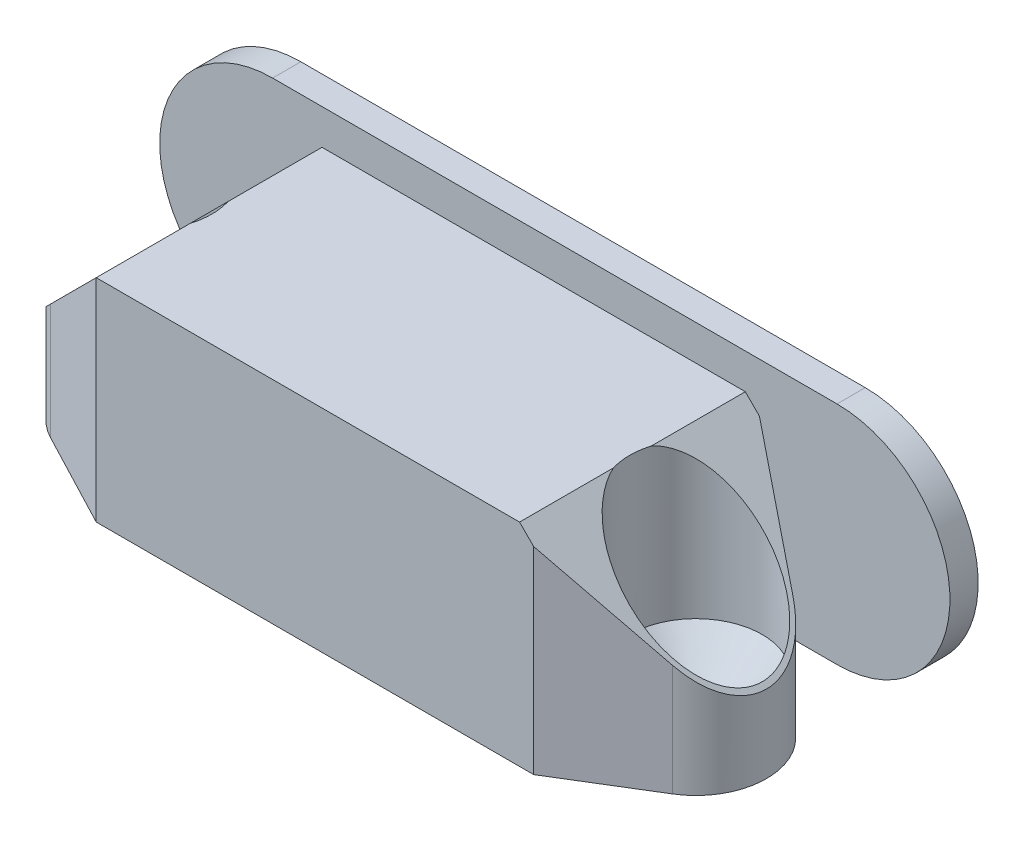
SolidWorks part; units mm, degrees
ref_plane "Plan de face" through (0, 0, 0) normal (0, 0, 1) x (1, 0, 0)
ref_plane "Plan de dessus" through (0, 0, 0) normal (0, 1, 0) x (1, 0, 0)
ref_plane "Plan de droite" through (0, 0, 0) normal (1, 0, 0) x (0, 0, -1)
sketch "Esquisse1" plane through (0, 0, 0) normal (0, 0, 1) x (1, 0, 0)
  line L0 (-20, -8) -> (20, -8)
  line L1 (20, 8) -> (-20, 8)
  arc A0 (20, -8) -> (20, 8) centre (20, 0) ccw
  arc A1 (-20, 8) -> (-20, -8) centre (-20, 0) ccw
  dimension "D1" = 8
  dimension "D2" = 56
  dimension "D3" = 28
extrude "Extrusion1" add sketch "Esquisse1" along normal blind 2
hole_wizard "Fraisage pour vis à tête fraisée M41" positions "Esquisse3" profile "Esquisse2" countersink size "M4" standard "ISO"
sketch "Esquisse3" plane through (0, 0, 2) normal (0, 0, 1) x (1, 0, 0)
  arc A0 (-20, 8) -> (-20, -8) centre (-20, 0) ccw construction
  arc A1 (20, -8) -> (20, 8) centre (20, 0) ccw construction
  point P0 (-20, 0)
  point P1 (20, 0)
sketch "Esquisse2" plane through (-20, 0, 2) normal (1, 0, 0) x (0, -1, 0)
  line L0 (0, 0) -> (0, 11.2919)
  line L1 (0, 11.2919) -> (2.15, 10)
  line L2 (2.15, 10) -> (2.15, 2.55)
  line L3 (2.15, 2.55) -> (4.7, 0)
  line L5 (4.7, 0) -> (0, 0)
  line L6 (-2.15, 2.55) -> (-4.7, 0) construction
  line L10 (0, 11.2919) -> (-2.15, 10) construction
  line L11 (0, -6.35) -> (0, 107.95) construction
  dimension "Diamètre du perçage" = 4.3
  dimension "Profondeur du perçage" = 10
  dimension "Diamètre du fraisage entrant" = 9.4
  dimension "Angle du fraisage entrant" = 90
  dimension "Angle de pointe" = 118
sketch "Esquisse5" plane through (0, -8, 0) normal (0, -1, 0) x (1, 0, 0)
  line L0 (-15, 3.5) -> (16, 3.5)
  line L1 (16, 3.5) -> (22.108, 7.234)
  line L2 (22.108, 15.766) -> (16, 19.5)
  line L3 (16, 19.5) -> (-15, 19.5)
  line L4 (-15, 19.5) -> (-21.8192, 15.9296)
  line L5 (-21.8192, 7.0704) -> (-15, 3.5)
  line L6 (-20, 2) -> (20, 2) construction
  arc A0 (22.108, 7.234) -> (22.108, 15.766) centre (19.5, 11.5) ccw
  arc A1 (-21.8192, 15.9296) -> (-21.8192, 7.0704) centre (-19.5, 11.5) ccw
  dimension "D3" = 49
  dimension "D5" = 5
  dimension "D6" = 5
  dimension "D1" = 16
  dimension "D2" = 1.5
  dimension "D4" = 24.5
  dimension "D7" = 8
  dimension "D8" = 31
  dimension "D9" = 9.5
extrude "Extrusion2" add sketch "Esquisse5" against normal blind 15
sketch "Esquisse6" plane through (0, 0, 19.5) normal (0, 0, 1) x (1, 0, 0)
  line L0 (-15, 7) -> (-30, -8)
  line L1 (-30, -8) -> (-30, 7)
  line L2 (-30, 7) -> (-15, 7)
  dimension "D1" = 45
  dimension "D2" = 15
extrude "Enlèv. mat.-Extru.1" cut sketch "Esquisse6" along direction (0, 0, -1) on the side against the normal up to next (17.5 mm away)
hole_wizard "Fraisage pour vis à tête fraisée M43" positions "Esquisse11" profile "Esquisse10" countersink size "M4" standard "ISO"
sketch "Esquisse11" plane through (0, 7, 0) normal (0, 1, 0) x (-1, 0, 0)
  arc A0 (21.8192, 7.0704) -> (21.8192, 15.9296) centre (19.5, 11.5) ccw construction
  point P0 (19.5, 11.5)
sketch "Esquisse10" plane through (-19.5, 7, 11.5) normal (1, 0, 0) x (0, 0, 1)
  line L0 (0, 0) -> (0, 26.2919)
  line L1 (0, 26.2919) -> (2.15, 25)
  line L2 (2.15, 25) -> (2.15, 13.55)
  line L3 (2.15, 13.55) -> (4.7, 11)
  line L4 (4.7, 11) -> (4.7, 0)
  line L6 (4.7, 0) -> (0, 0)
  line L7 (-2.15, 13.55) -> (-4.7, 11) construction
  line L10 (0, 26.2919) -> (-2.15, 25) construction
  line L11 (0, -6.35) -> (0, 107.95) construction
  dimension "Diamètre du perçage" = 4.3
  dimension "Profondeur du perçage" = 25
  dimension "Diamètre du fraisage" = 9.4
  dimension "Angle du fraisage" = 90
  dimension "Angle de pointe" = 118
  dimension "Dégagement de la tête" = 11
mirror "Symétrie1" about plane through (0, 0, 0) normal (1, 0, 0) of "Fraisage pour vis à tête fraisée M43", "Enlèv. mat.-Extru.1"
